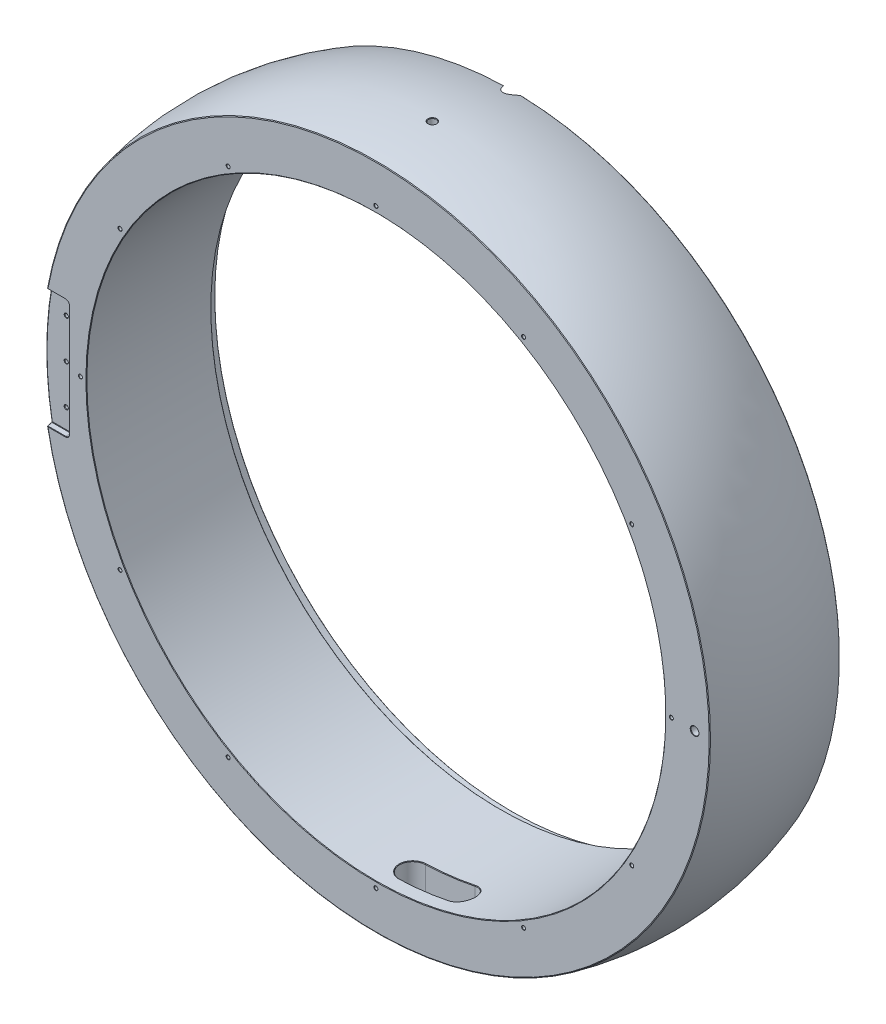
SolidWorks part; units mm, degrees
ref_plane "Спереди" through (0, 0, 0) normal (0, 0, 1) x (1, 0, 0)
ref_plane "Сверху" through (0, 0, 0) normal (0, 1, 0) x (1, 0, 0)
ref_plane "Справа" through (0, 0, 0) normal (1, 0, 0) x (0, 0, -1)
sketch "Эскиз1" plane through (0, 0, 0) normal (1, 0, 0) x (0, 0, -1)
  line L0 (0, 0) -> (69, 0) construction
  line L1 (0, 168.4487) -> (57, 168.4487) construction
  line L2 (28.5, 47.08) -> (28.5, 171.75) construction
  line L3 (0, 146) -> (63, 146)
  line L4 (69, 150) -> (69, 164.9883)
  line L5 (0, 146) -> (0, 168.4487)
  line L6 (8.5, 168.4487) -> (8.5, 182.2575) construction
  line L7 (-10.8254, 171.75) -> (65.4952, 171.75) construction
  line L8 (63, 146) -> (63, 150)
  line L9 (63, 150) -> (69, 150)
  line L10 (48.5, 168.4487) -> (48.5, 182.2575) construction
  line L11 (8.5, 170.1353) -> (48.5, 170.1353) construction
  arc A0 (69, 164.9883) -> (0, 168.4487) centre (28.5, 47.08) ccw
  dimension "D5" = 249.34
  dimension "D1" = 292
  dimension "D2" = 28.5
  dimension "D3" = 40
  dimension "D4" = 171.75
  dimension "D6" = 69
  dimension "D8" = 300
  dimension "D9" = 6
revolve "Повернуть1" add sketch "Эскиз1" angle 360 about L0
sketch "Эскиз3" plane through (0, 0, -69) normal (0, 0, -1) x (-1, 0, 0)
  line L0 (0, 164.9883) -> (0, 0) construction
  line L1 (-6.8317, 153.4792) -> (-6.596, 160.2303)
  line L2 (6.8317, 153.4792) -> (6.596, 160.2303)
  circle A0 centre (0, 0) radius 164.9883 construction
  arc A1 (6.596, 160.2303) -> (-6.596, 160.2303) centre (0, 160) ccw
  circle A2 centre (0, 0) radius 150 construction
  arc A3 (-10.548, 149.6287) -> (10.548, 149.6287) centre (0, 0) ccw
  arc A4 (6.8317, 153.4792) -> (10.548, 149.6287) centre (10.8293, 153.6188) ccw
  arc A5 (-6.8317, 153.4792) -> (-10.548, 149.6287) centre (-10.8293, 153.6188) cw
  circle A6 centre (0, 0) radius 157.5 construction
  circle A7 centre (-40, 152.336) radius 4
  circle A8 centre (40, 152.336) radius 4
  circle A9 centre (-90, -129.2527) radius 4
  circle A10 centre (90, -129.2527) radius 4
  dimension "D1" = 13.2
  dimension "D4" = 4
  dimension "D5" = 315
  dimension "D6" = 8
  dimension "D2" = 160
  dimension "D3" = 4
  dimension "D7" = 40
  dimension "D8" = 90
extrude "Вырез-Вытянуть2" cut sketch "Эскиз3" against normal blind 6
sketch "Эскиз4" plane through (0, 0, 0) normal (0, 1, 0) x (1, 0, 0)
  line L0 (-168.4487, 0) -> (168.4487, 0) construction
  line L3 (0, 0) -> (0, 69) construction
  line L4 (150, 69) -> (-150, 69) construction
  line L5 (30, 7) -> (5, 7)
  line L6 (30, 20) -> (5, 20)
  arc A2 (5, 7) -> (5, 20) centre (5, 13.5) cw
  arc A3 (30, 20) -> (30, 7) centre (30, 13.5) cw
  point P2 (-36.0138, 13.4587)
  point P3 (-35.1408, -3.8928)
  dimension "D4" = 6.5
  dimension "D1" = 7
  dimension "D2" = 13
  dimension "D3" = 5
  dimension "D5" = 25
extrude "Вырез-Вытянуть3" cut sketch "Эскиз4" against normal through all
sketch "Эскиз5" plane through (0, 0, 0) normal (0, 1, 0) x (1, 0, 0)
  circle A0 centre (0, 28.5) radius 2
  dimension "D1" = 4
  dimension "D2" = 28.5
extrude "Вырез-Вытянуть4" cut sketch "Эскиз5" along normal through all
chamfer "Фаска1" distance 0.25 angle 45 30 edges at (1.4616, 171.7363, -27.1348) (146, 0, -63) (7.9512, 150.8409, -69) (7.9512, 150.8409, -63) (6.7139, 156.8548, -69) (6.7139, 156.8548, -63) (0, 166.6, -63) (-6.7139, 156.8548, -69) (-6.7139, 156.8548, -63) (-7.9512, 150.8409, -69) (-7.9512, 150.8409, -63) (0, -150, -63) (0, -164.9883, -69) (-5.9736, 162.8064, -69) (5.9736, 162.8064, -69) (0, -150, -69) (36, 152.336, -69) (-36, 152.336, -69) (86, -129.2527, -69) (-86, -129.2527, -69) (168.4487, 0, 0) (146, 0, 0) (17.5654, -144.9395, -7) (-1.4569, -145.9927, -14.2476) (36.439, -141.3796, -12.6115) (17.5654, -144.9395, -20) (17.5481, -168.9734, -7) (36.4712, -166.9803, -14.1111) (-1.463, -170.7521, -12.8072) (17.5472, -170.5596, -20)
sketch "Эскиз6" plane through (0, 0, 0) normal (0, 0, 1) x (1, 0, 0)
  line L0 (0, 0) -> (0, 149) construction
  line L1 (0, 0) -> (74.5, 129.0378) construction
  circle A0 centre (0, 0) radius 149 construction
  circle A2 centre (0, 149) radius 0.8625
  circle A3 centre (74.5, 129.0378) radius 0.8625
  circle A4 centre (129.0378, 74.5) radius 0.8625
  circle A5 centre (149, 0) radius 0.8625
  circle A6 centre (129.0378, -74.5) radius 0.8625
  circle A7 centre (74.5, -129.0378) radius 0.8625
  circle A8 centre (0, -149) radius 0.8625
  circle A9 centre (-74.5, -129.0378) radius 0.8625
  circle A10 centre (-129.0378, -74.5) radius 0.8625
  circle A11 centre (-149, 0) radius 0.8625
  circle A12 centre (-129.0378, 74.5) radius 0.8625
  circle A13 centre (-74.5, 129.0378) radius 0.8625
  dimension "D1" = 298
  dimension "D2" = 1.725
  dimension "D4" = 30
  dimension "D3" = 12
extrude "Вырез-Вытянуть5" cut sketch "Эскиз6" against normal blind 10
chamfer "Фаска2" distance 0.15 angle 45 12 edges at (-73.6375, 129.0378, 0) (-128.1753, 74.5, 0) (-148.1375, 0, 0) (-128.1753, -74.5, 0) (-73.6375, -129.0378, 0) (0.8625, -149, 0) (75.3625, -129.0378, 0) (129.9003, -74.5, 0) (129.9003, 74.5, 0) (149.8625, 0, 0) (75.3625, 129.0378, 0) (0.8625, 149, 0)
sketch "Эскиз7" plane through (0, 0, -63) normal (0, 0, -1) x (-1, 0, 0)
  circle A0 centre (0, 156.05) radius 2
  dimension "D1" = 4
  dimension "D2" = 156.05
extrude "Вырез-Вытянуть6" cut sketch "Эскиз7" against normal blind 25
chamfer "Фаска3" distance 0.25 angle 45 2 edges at (-2, 156.05, -63) (-2, 156.05, -38)
chamfer "Фаска4" distance 1.66 angle 45 1 edges at (-0.4598, 145.9993, -26.5536)
sketch "Эскиз9" plane through (0, 0, 0) normal (0, 0, 1) x (1, 0, 0)
  circle A0 centre (-159.137, 20) radius 0.8625
  circle A1 centre (-159.137, 0) radius 0.8625
  circle A2 centre (-159.137, -20) radius 0.8625
  circle A3 centre (0, 0) radius 146.25 construction
  dimension "D3" = 1.725
  dimension "D1" = 20
  dimension "D2" = 20
  dimension "D4" = 159.137
extrude "Вырез-Вытянуть7" cut sketch "Эскиз9" against normal blind 15
sketch "Эскиз10" plane through (0, 0, 0) normal (0, 0, 1) x (1, 0, 0)
  line L0 (-159.137, 20) -> (-159.137, -19.1375) construction
  line L1 (-182.1414, 30) -> (-156.637, 30)
  line L2 (-182.1414, 30) -> (-182.1414, -30)
  line L3 (-182.1414, -30) -> (-156.637, -30)
  line L4 (-154.637, 28) -> (-154.637, -28)
  circle A0 centre (-159.137, -20) radius 0.8625 construction
  circle A1 centre (-159.137, -20) radius 0.8625 construction
  arc A2 (-156.637, -30) -> (-154.637, -28) centre (-156.637, -28) ccw
  arc A3 (-156.637, 30) -> (-154.637, 28) centre (-156.637, 28) cw
  dimension "D4" = 2
  dimension "D1" = 60
  dimension "D2" = 30
  dimension "D3" = 9
extrude "Вырез-Вытянуть8" cut sketch "Эскиз10" against normal blind 3
sketch "Эскиз12" plane through (0, 0, 0) normal (0, 0, 1) x (1, 0, 0)
  circle A0 centre (160.73, 0) radius 2
  dimension "D1" = 4
  dimension "D2" = 160.73
extrude "Вырез-Вытянуть9" cut sketch "Эскиз12" against normal blind 13
chamfer "Фаска5" distance 0.2 angle 45 14 edges at (-161.0258, 30, 0) (-155.2228, 29.4142, 0) (-161.0258, -30, 0) (-154.637, 0, 0) (-155.2228, -29.4142, 0) (-161.5345, 30, -3) (-155.2228, 29.4142, -3) (-154.637, 0, -3) (-155.2228, -29.4142, -3) (-161.5345, -30, -3) (-158.2745, -20, -3) (-158.2745, 0, -3) (-158.2745, 20, -3) (162.73, 0, 0)
chamfer "Фаска6" distance 0.2 angle 45 5 edges at (168.0417, 30, -44.6574) (165.999, -30, -55.9604) (-169.1143, 0, -3)
